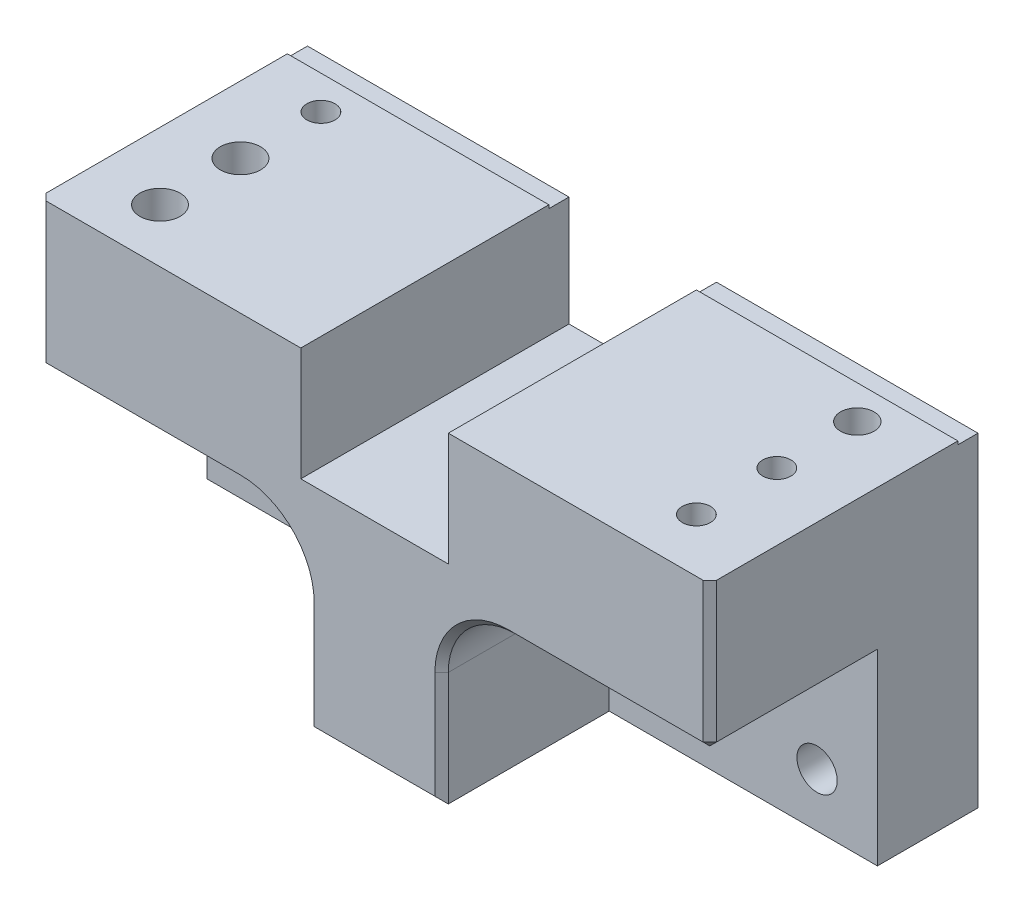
SolidWorks part; units mm, degrees
ref_plane "Plan de face" through (0, 0, 0) normal (0, 0, 1) x (1, 0, 0)
ref_plane "Plan de dessus" through (0, 0, 0) normal (0, 1, 0) x (1, 0, 0)
ref_plane "Plan de droite" through (0, 0, 0) normal (1, 0, 0) x (0, 0, -1)
sketch "Esquisse1" plane through (0, 0, 0) normal (0, 0, 1) x (1, 0, 0)
  line L0 (0, 83.2004) -> (0, -7.525) construction
  line L1 (-50, 48.9) -> (-11, 48.9)
  line L2 (-50, 48.9) -> (-50, 0)
  line L3 (-50, 0) -> (50, 0)
  line L4 (50, 48.9) -> (50, 0)
  line L5 (78, 57) -> (78, 0) construction
  line L6 (-78, 57) -> (-78, 0) construction
  line L7 (11, 42) -> (30, 42) construction
  line L9 (11, 32) -> (11, 42) construction
  line L10 (-11, 32) -> (11, 32) construction
  line L11 (-11, 32) -> (-11, 42) construction
  line L12 (11, 32) -> (11, 48.9)
  line L13 (-11, 32) -> (11, 32)
  line L14 (-11, 32) -> (-11, 48.9)
  line L15 (11, 48.9) -> (50, 48.9)
  line L16 (-78, 0) -> (78, 0) construction
  dimension "D1" = 100
  dimension "D2" = 6.9
extrude "Extrusion1" add sketch "Esquisse1" along normal blind 40
sketch "Esquisse2" plane through (0, 48.9, 0) normal (0, 1, 0) x (-1, 0, 0)
  line L0 (0, 14.2955) -> (0, 55.6949) construction
  line L1 (11, 40) -> (11, 0) construction
  line L2 (-11, 40) -> (-11, 0) construction
  line L3 (57.1877, 20) -> (-54.8405, 20) construction
  line L4 (11, 0) -> (50, 0) construction
  line L5 (11, 40) -> (50, 40) construction
  circle A0 centre (40, 32) radius 3.004
  circle A1 centre (-40, 8) radius 2.5035
  circle A2 centre (40, 20) radius 3.004
  dimension "D1" = 5.007
  dimension "D2" = 6.008
  dimension "D3" = 40
  dimension "D4" = 40
  dimension "D5" = 12
  dimension "D6" = 12
  dimension "D7" = 40
extrude "Enlèv. mat.-Extru.1" cut sketch "Esquisse2" against normal blind 15
hole_wizard "Trou taraudé M5x0.81" positions "Esquisse3D1" profile "Esquisse3" tap size "M5x0.8" standard "Ansi Métrique"
sketch3d "Esquisse3D1"
  line L2 (-57.1877, 48.9, 20) -> (54.8405, 48.9, 20) construction
  line L3 (-57.1877, 48.9, 20) -> (54.8405, 48.9, 20) construction
  line L4 (0, 48.9, 14.2955) -> (0, 48.9, 55.6949) construction
  line L5 (0, 48.9, 14.2955) -> (0, 48.9, 55.6949) construction
  point P0 (-40, 48.9, 8)
  point P2 (40, 48.9, 32)
  point P20 (40, 48.9, 20)
  dimension "D1" = 40
  dimension "D2" = 40
  dimension "D3" = 12
  dimension "D4" = 12
  dimension "D5" = 40
sketch "Esquisse3" plane through (-40, 48.9, 8) normal (1, 0, 0) x (0, 0, 1)
  line L0 (0, 0) -> (0, 13.6618)
  line L1 (0, 13.6618) -> (2.1, 12.4)
  line L2 (2.1, 12.4) -> (2.1, 0)
  line L5 (2.1, 0) -> (0, 0)
  line L10 (0, 13.6618) -> (-2.1, 12.4) construction
  line L11 (0, -6.35) -> (0, 107.95) construction
  dimension "Diamètre du trou pour taraudage" = 4.2
  dimension "Profondeur du trou pour taraudage" = 12.4
  dimension "Angle de pointe" = 118
sketch "Esquisse4" plane through (0, 0, 40) normal (0, 0, 1) x (1, 0, 0)
  line L0 (-50, 27) -> (-20, 27)
  line L1 (-10, 17) -> (-10, 0)
  line L2 (10, 17) -> (10, 0)
  line L3 (0, 28.8222) -> (0, -9.4228) construction
  line L4 (50, 0) -> (50, 48.9) construction
  line L5 (-50, 48.9) -> (-50, 0) construction
  line L6 (20, 27) -> (50, 27)
  line L7 (11, 32) -> (-11, 32) construction
  line L9 (10, 0) -> (50, 0)
  line L16 (-50, 48.9) -> (-50, 0)
  line L17 (-50, 0) -> (50, 0)
  line L18 (50, 0) -> (50, 48.9)
  line L19 (50, 48.9) -> (11, 48.9)
  line L20 (11, 48.9) -> (11, 32)
  line L21 (11, 32) -> (-11, 32)
  line L22 (-11, 32) -> (-11, 48.9)
  line L23 (-11, 48.9) -> (-50, 48.9)
  line L24 (-50, 27) -> (-50, 0)
  line L25 (-50, 0) -> (-10, 0)
  line L26 (50, 0) -> (50, 27)
  arc A0 (-10, 17) -> (-20, 27) centre (-20, 17) ccw
  arc A1 (20, 27) -> (10, 17) centre (20, 17) ccw
  dimension "D2" = 10
  dimension "D1" = 20
  dimension "D3" = 5
  dimension "D4" = 0
extrude "Enlèv. mat.-Extru.2" cut sketch "Esquisse4" against normal blind 25
sketch "Esquisse5" plane through (0, 48.9, 0) normal (0, 1, 0) x (-1, 0, 0)
  line L0 (-50, 0) -> (-11, 0) construction
  line L1 (-50, 0) -> (50, 0)
  line L2 (-50, 40) -> (-50, 0) construction
  line L3 (-50, 3) -> (-50, 0)
  line L4 (50, 40) -> (50, 0) construction
  line L5 (50, 3) -> (50, 0)
  line L8 (50, 3) -> (-50, 3)
  dimension "D1" = 3
extrude "Enlèv. mat.-Extru.3" cut sketch "Esquisse5" against normal blind 0.5
sketch "Esquisse6" plane through (0, 0, 15) normal (0, 0, 1) x (1, 0, 0)
  line L0 (0, 24.3287) -> (0, -12.0895) construction
  line L1 (50, 0) -> (50, 27) construction
  line L2 (-50, 27) -> (-50, 0) construction
  line L3 (10, 0) -> (50, 0) construction
  circle A0 centre (41, 8) radius 3.004
  circle A1 centre (-41, 8) radius 3.004
  dimension "D1" = 6.008
  dimension "D3" = 9
  dimension "D2" = 8
extrude "Enlèv. mat.-Extru.4" cut sketch "Esquisse6" against normal through all
hole_wizard "Chambrage pour vis à tête cylindrique à 6 pans creux (ou vis CHC) M51" positions "Esquisse8" profile "Esquisse7" counterbore size "M5" standard "Ansi Métrique"
sketch "Esquisse8" plane through (0, 0, 15) normal (0, 0, 1) x (1, 0, 0)
  arc A0 (-10, 17) -> (-20, 27) centre (-20, 17) ccw construction
  arc A1 (20, 27) -> (10, 17) centre (20, 17) ccw construction
  point P0 (20, 17)
  point P1 (-20, 17)
sketch "Esquisse7" plane through (20, 17, 15) normal (1, 0, 0) x (0, -1, 0)
  line L0 (0, 0) -> (0, 15)
  line L1 (0, 15) -> (2.75, 15)
  line L3 (2.75, 15) -> (2.75, 5)
  line L4 (2.75, 5) -> (5, 5)
  line L5 (5, 5) -> (5, 0)
  line L7 (5, 0) -> (0, 0)
  line L11 (0, -6.35) -> (0, 107.95) construction
  dimension "Diamètre du perçage jusqu'au prochain" = 5.5
  dimension "Profondeur du perçage jusqu'au prochain" = 15
  dimension "Diamètre du chambrage" = 10
  dimension "Profondeur du chambrage" = 5
chamfer "Chanfrein1" distance 1 angle 45 11 edges at (-50, 37.95, 40) (-35, 27, 40) (-12.9289, 24.0711, 40) (-10, 8.5, 40) (0, 0, 40) (10, 8.5, 40) (12.9289, 24.0711, 40) (35, 27, 40) (50, 37.95, 40) (-50, 27, 27.5) (50, 27, 27.5)
